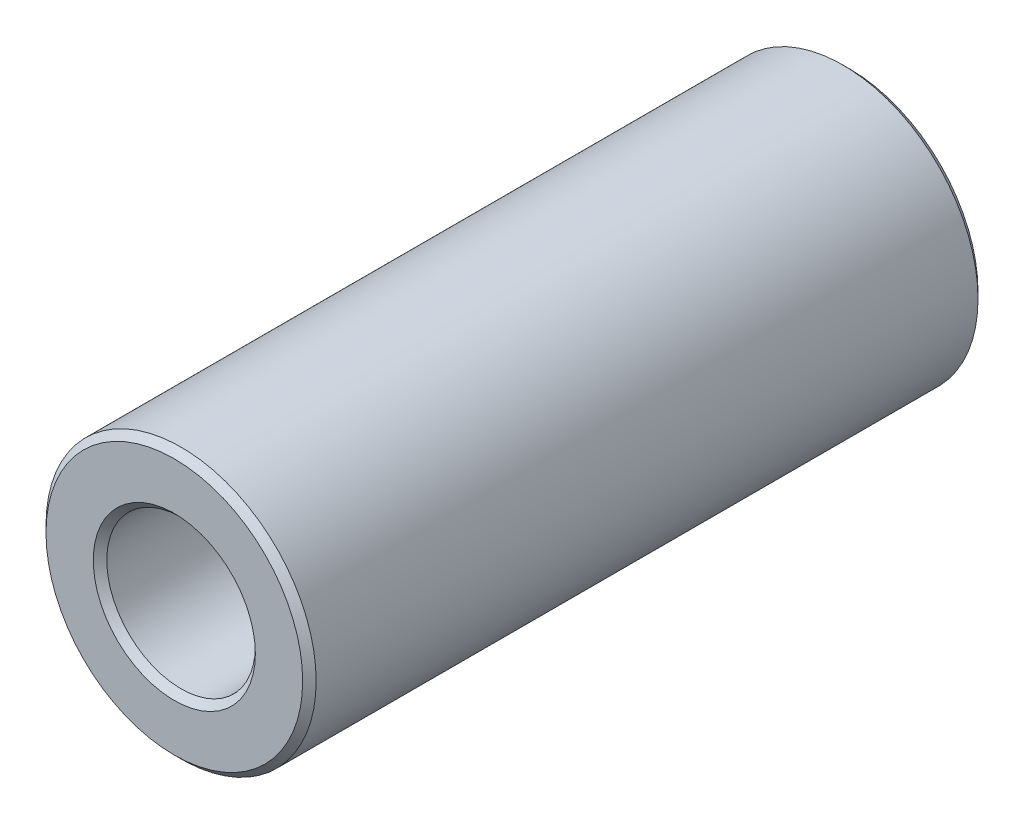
SolidWorks part; units mm, degrees
ref_plane "Front Plane" through (0, 0, 0) normal (0, 0, 1) x (1, 0, 0)
ref_plane "Top Plane" through (0, 0, 0) normal (0, 1, 0) x (1, 0, 0)
ref_plane "Right Plane" through (0, 0, 0) normal (1, 0, 0) x (0, 0, -1)
sketch "Sketch1" plane through (0, 0, 0) normal (0, 0, 1) x (1, 0, 0)
  circle A0 centre (0, 0) radius 2
  circle A1 centre (0, 0) radius 1.1
  dimension "D1" = 4
  dimension "D2" = 2.2
extrude "Boss-Extrude2" add sketch "Sketch1" along normal mid plane 10
chamfer "Chamfer3" distance 0.1 angle 45 4 edges at (2, 0, 5) (2, 0, -5) (1.1, 0, -5) (1.1, 0, 5)
